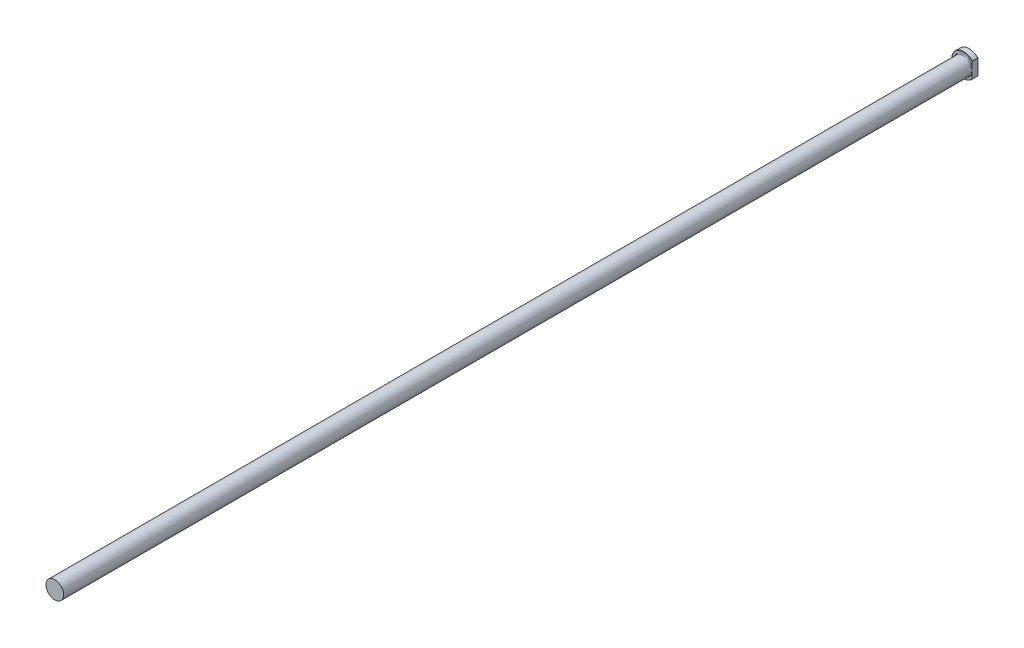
SolidWorks part; units mm, degrees
ref_plane "Front Plane" through (0, 0, 0) normal (0, 0, 1) x (1, 0, 0)
ref_plane "Top Plane" through (0, 0, 0) normal (0, 1, 0) x (1, 0, 0)
ref_plane "Right Plane" through (0, 0, 0) normal (1, 0, 0) x (0, 0, -1)
sketch "Sketch2" plane through (0, 0, 0) normal (1, 0, 0) x (0, 0, 1)
  line L0 (-2.1475, 0) -> (290.2977, 0) construction
  line L1 (990.6, 0) -> (0, 0)
  line L2 (0, 0) -> (0, 12.7)
  line L3 (0, 12.7) -> (6.35, 12.7)
  line L4 (6.35, 10.287) -> (6.35, 12.7)
  line L7 (7.112, 9.525) -> (990.6, 9.525)
  line L8 (990.6, 0) -> (990.6, 9.525)
  arc A0 (7.112, 9.525) -> (6.35, 10.287) centre (7.112, 10.287) cw
revolve "Revolve1" add sketch "Sketch2" angle 360 about L0
sketch "Sketch4" plane through (0, 0, 0) normal (0, 0, 1) x (1, 0, 0)
  line L1 (9.525, 8.4003) -> (9.525, -8.4003)
  arc A3 (9.525, -8.4003) -> (9.525, 8.4003) centre (0, 0) ccw
extrude "Cut-Extrude2" cut sketch "Sketch4" along normal blind 7.62
chamfer "Chamfer1" distance 0.254 angle 45 2 edges at (-12.7, 0, 6.35) (-12.7, 0, 0)
equation "\"D1@Sketch4\"=0.5*\"D3@Sketch2\""
equation "\"D2@Sketch4\"=\"D1@Sketch2\""
